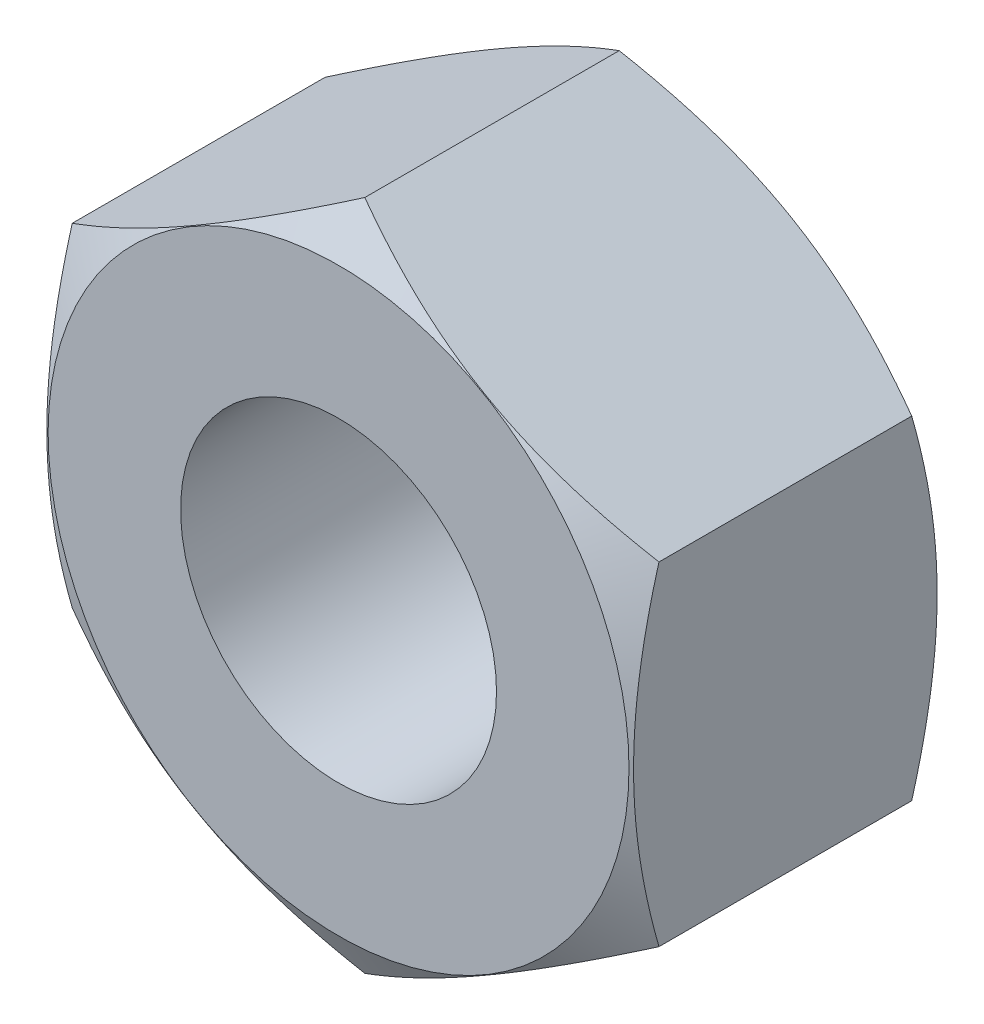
SolidWorks part; units mm, degrees
ref_plane "Plane1" through (0, 0, 0) normal (0, 0, 1) x (1, 0, 0)
ref_plane "Plane2" through (0, 0, 0) normal (0, 1, 0) x (1, 0, 0)
ref_plane "Plane3" through (0, 0, 0) normal (1, 0, 0) x (0, 0, -1)
sketch "Esquisse1" plane through (0, 0, 0) normal (0, 0, 1) x (1, 0, 0)
  circle A0 centre (0, 0) radius 7.475
  dimension "D1" = 14.95
extrude "Base-Extrusion" add sketch "Esquisse1" along normal blind 6.8
chamfer "Chanfrein1" distance 0.6 angle 60
sketch "Esquisse2" plane through (0, 0, 6.8) normal (0, 0, 1) x (1, 0, 0)
  line L0 (-6.5, 3.6913) -> (-6.5, -3.6913)
  line L1 (-6.5, -3.6913) -> (0, -7.4441)
  line L2 (0, -7.4441) -> (6.5, -3.6913)
  line L3 (6.5, -3.6913) -> (6.5, 3.6913)
  line L4 (6.5, 3.6913) -> (0, 7.4441)
  line L5 (0, 7.4441) -> (-6.5, 3.6913)
  circle A0 centre (0, 0) radius 7.475 construction
  dimension "D1" = 6.5
  dimension "D2" = 6.5
  dimension "D3" = 120
  dimension "D4" = 120
  dimension "D5" = 120
  dimension "D6" = 120
extrude "Enlèv. mat.-Extru.1" cut sketch "Esquisse2" against normal through all flip side to cut
sketch "Esquisse3" plane through (0, 0, 6.8) normal (0, 0, 1) x (1, 0, 0)
  circle A0 centre (0, 0) radius 3.5
  dimension "D1" = 7
extrude "Enlèv. mat.-Extru.2" cut sketch "Esquisse3" against normal through all
